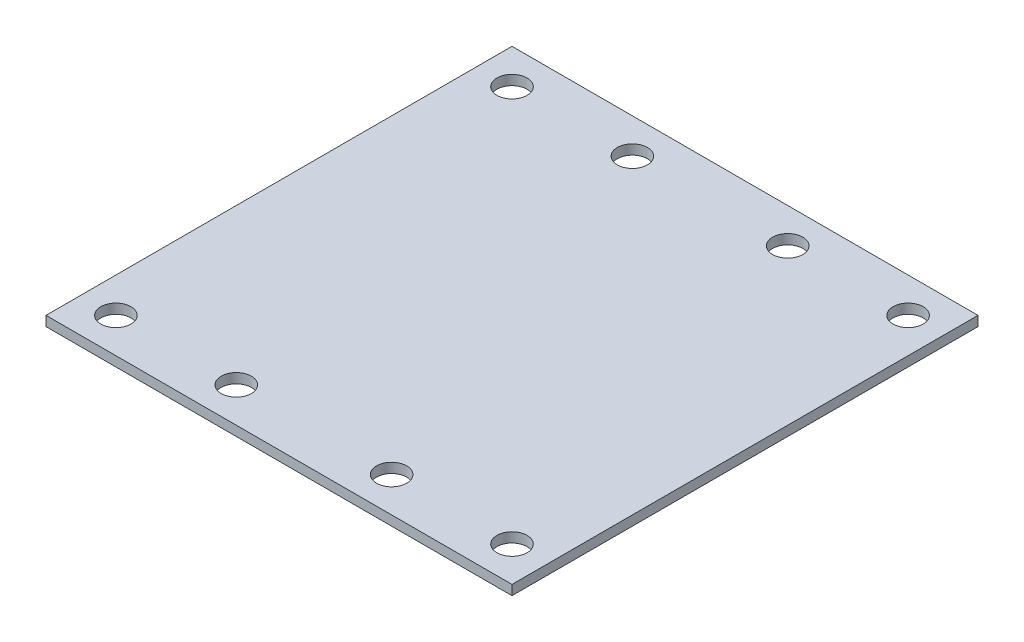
SolidWorks part; units mm, degrees
ref_plane "Front Plane" through (0, 0, 0) normal (0, 0, 1) x (1, 0, 0)
ref_plane "Top Plane" through (0, 0, 0) normal (0, 1, 0) x (1, 0, 0)
ref_plane "Right Plane" through (0, 0, 0) normal (1, 0, 0) x (0, 0, -1)
sketch "Sketch1" plane through (0, 0, 0) normal (0, 1, 0) x (1, 0, 0)
  line L0 (-32.385, 32.385) -> (32.385, 32.385) construction
  line L1 (-38.1, -38.1) -> (38.1, -38.1)
  line L2 (-38.1, -38.1) -> (-38.1, 38.1)
  line L3 (-38.1, 38.1) -> (38.1, 38.1)
  line L4 (38.1, -38.1) -> (38.1, 38.1)
  line L5 (-38.1, -38.1) -> (38.1, 38.1) construction
  line L6 (-38.1, 38.1) -> (38.1, -38.1) construction
  line L7 (-33.1951, 32.385) -> (31.5749, 32.385) construction
  line L8 (0, 0) -> (0, 32.385) construction
  line L9 (0, 0) -> (18.8347, 0) construction
  circle A0 centre (-32.385, 32.385) radius 2.4638
  circle A1 centre (32.385, 32.385) radius 2.4638
  circle A2 centre (32.385, -32.385) radius 2.4638
  circle A3 centre (-32.385, -32.385) radius 2.4638
  circle A4 centre (-12.7, 32.385) radius 2.4638
  circle A5 centre (12.7, 32.385) radius 2.4638
  circle A6 centre (12.7, -32.385) radius 2.4638
  circle A7 centre (-12.7, -32.385) radius 2.4638
  point P0 (0, 0)
  dimension "D3" = 4.9276
  dimension "D1" = 76.2
  dimension "D2" = 76.2
  dimension "D4" = 64.77
  dimension "D5" = 64.77
  dimension "D6" = 25.4
extrude "Boss-Extrude1" add sketch "Sketch1" along normal blind 1.6002
